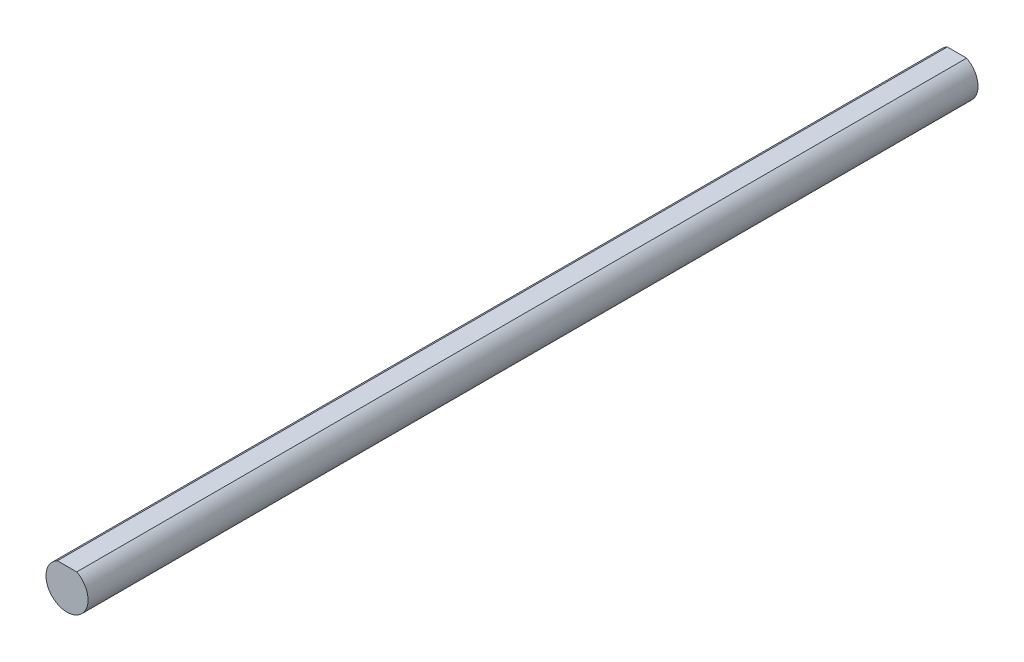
SolidWorks part; units mm, degrees
ref_plane "Front Plane" through (0, 0, 0) normal (0, 0, 1) x (1, 0, 0)
ref_plane "Top Plane" through (0, 0, 0) normal (0, 1, 0) x (1, 0, 0)
ref_plane "Right Plane" through (0, 0, 0) normal (1, 0, 0) x (0, 0, -1)
sketch "Sketch1" plane through (0, 0, 0) normal (0, 0, 1) x (1, 0, 0)
  line L0 (-1.0878, 2.1) -> (1.0878, 2.1)
  arc A0 (-1.0878, 2.1) -> (1.0878, 2.1) centre (0, 0) ccw
  dimension "D1" = 4.73
  dimension "D2" = 2.1
extrude "Extrude1" add sketch "Sketch1" against normal blind 100
